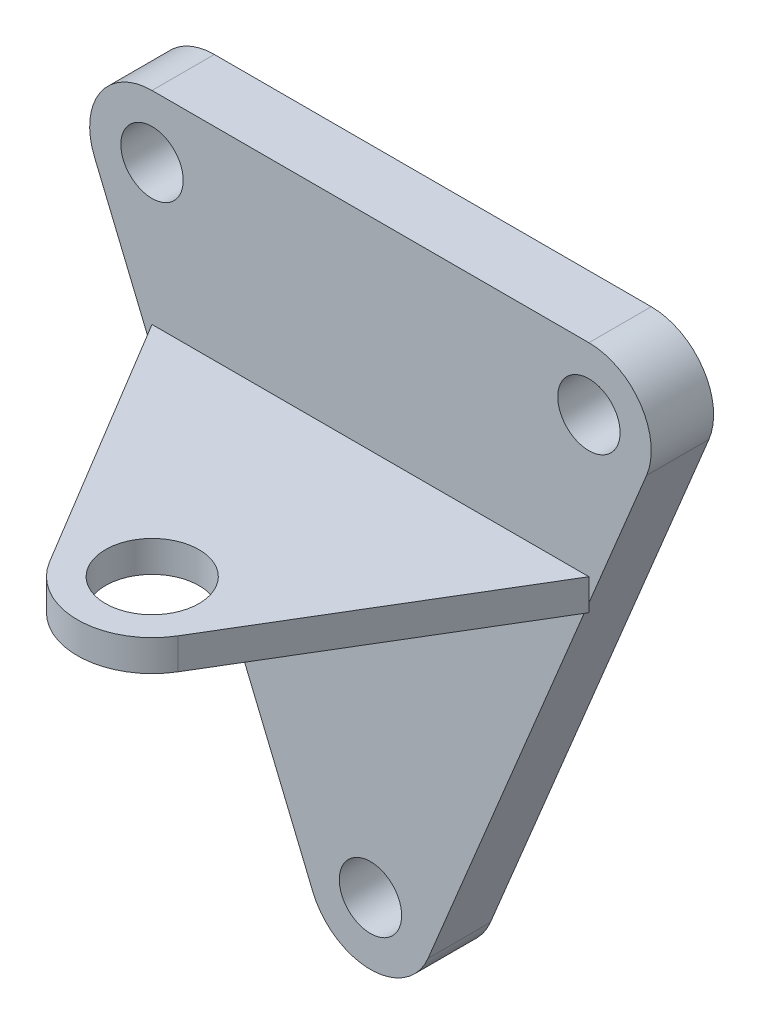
SolidWorks part; units mm, degrees
ref_plane "Front Plane" through (0, 0, 0) normal (0, 0, 1) x (1, 0, 0)
ref_plane "Top Plane" through (0, 0, 0) normal (0, 1, 0) x (1, 0, 0)
ref_plane "Right Plane" through (0, 0, 0) normal (1, 0, 0) x (0, 0, -1)
sketch "Sketch1" plane through (0, 0, 0) normal (0, 0, 1) x (1, 0, 0)
  line L0 (-35.0339, 0) -> (35.0339, 0)
  line L1 (44.2727, -13.8268) -> (9.2388, -98.4063)
  line L2 (-9.2388, -98.4063) -> (-44.2727, -13.8268)
  line L3 (0, 0) -> (0, -120.7107) construction
  arc A0 (9.2388, -98.4063) -> (-9.2388, -98.4063) centre (0, -94.5794) cw
  arc A1 (35.0339, 0) -> (44.2727, -13.8268) centre (35.0339, -10) cw
  arc A2 (-35.0339, 0) -> (-44.2727, -13.8268) centre (-35.0339, -10) ccw
  circle A3 centre (35.0339, -10) radius 5
  circle A4 centre (-35.0339, -10) radius 5
  circle A5 centre (0, -94.5794) radius 5
  point P10 (50, 0)
  point P13 (-50, 0)
  dimension "D3" = 10
  dimension "D4" = 10
  dimension "D1" = 100
  dimension "D2" = 45
extrude "Extrude1" add sketch "Sketch1" along normal blind 10
ref_plane "Plane1" through (15, 0, 0) normal (1, 0, 0) x (0, 0, -1)
ref_plane "Plane2" through (0, -35, 0) normal (0, 1, 0) x (-1, 0, 0)
sketch "Sketch3" plane through (0, -35, 0) normal (0, 1, 0) x (-1, 0, 0)
  line L0 (35.0339, 10) -> (-35.0339, 10)
  line L2 (-35.0339, 10) -> (-10.2855, 51.1812)
  line L3 (10.2855, 51.1812) -> (35.0339, 10)
  arc A0 (-10.2855, 51.1812) -> (10.2855, 51.1812) centre (0, 45) cw
  circle A1 centre (0, 45) radius 7.5
  dimension "D3" = 12
  dimension "D4" = 15
  dimension "D2" = 35
extrude "Extrude3" add sketch "Sketch3" against normal mid plane 5
